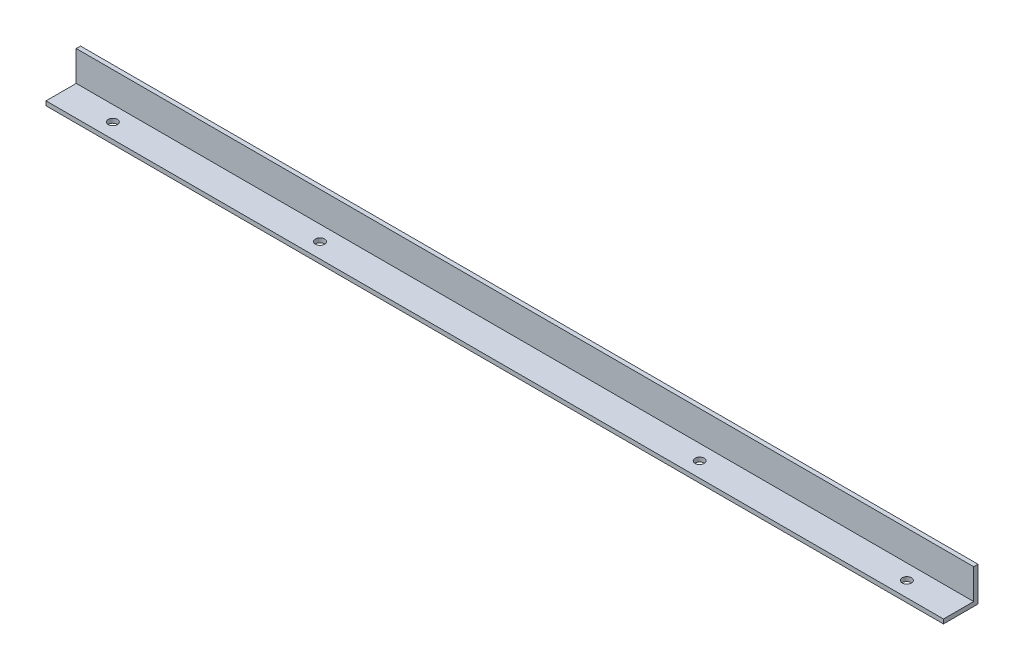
SolidWorks part; units mm, degrees
ref_plane "Front Plane" through (0, 0, 0) normal (0, 0, 1) x (1, 0, 0)
ref_plane "Top Plane" through (0, 0, 0) normal (0, 1, 0) x (1, 0, 0)
ref_plane "Right Plane" through (0, 0, 0) normal (1, 0, 0) x (0, 0, -1)
sketch "Sketch1" plane through (0, 0, 0) normal (0, 1, 0) x (1, 0, 0)
  line L1 (-330.2, 12.7) -> (330.2, 12.7)
  line L2 (-330.2, 12.7) -> (-330.2, -12.7)
  line L3 (-330.2, -12.7) -> (330.2, -12.7)
  line L4 (330.2, 12.7) -> (330.2, -12.7)
  line L5 (-330.2, 12.7) -> (330.2, -12.7) construction
  line L6 (-330.2, -12.7) -> (330.2, 12.7) construction
  point P0 (0, 0)
  dimension "D1" = 660.4
  dimension "D2" = 25.4
extrude "Boss-Extrude1" add sketch "Sketch1" along normal blind 3.175
sketch "Sketch2" plane through (0, 3.175, 0) normal (0, 1, 0) x (1, 0, 0)
  line L0 (-330.2, 12.7) -> (-330.2, 9.525)
  line L1 (-330.2, 12.7) -> (-330.2, -12.7) construction
  line L2 (-330.2, 9.525) -> (330.2, 9.525)
  line L3 (330.2, -12.7) -> (330.2, 12.7) construction
  line L4 (330.2, 9.525) -> (330.2, 12.7)
  line L5 (330.2, 12.7) -> (-330.2, 12.7)
  dimension "D1" = 3.175
extrude "Boss-Extrude2" add sketch "Sketch2" along normal blind 22.225
sketch "Sketch3" plane through (0, 3.175, 0) normal (0, 1, 0) x (1, 0, 0)
  line L0 (-330.2, -1.5875) -> (330.2, -1.5875) construction
  line L1 (-330.2, 9.525) -> (-330.2, -12.7) construction
  line L2 (330.2, -12.7) -> (330.2, 9.525) construction
  line L3 (-330.2, -12.7) -> (330.2, -12.7) construction
  circle A0 centre (-292.1, -1.5875) radius 3.3782
  circle A1 centre (-139.7, -1.5875) radius 3.3782
  circle A2 centre (292.1, -1.5875) radius 3.3782
  circle A3 centre (139.7, -1.5875) radius 3.3782
  dimension "D2" = 6.7564
  dimension "D3" = 6.7564
  dimension "D4" = 6.7564
  dimension "D5" = 6.7564
  dimension "D1" = 11.1125
  dimension "D6" = 38.1
  dimension "D7" = 152.4
  dimension "D8" = 38.1
  dimension "D9" = 152.4
extrude "Cut-Extrude1" cut sketch "Sketch3" against normal through all
